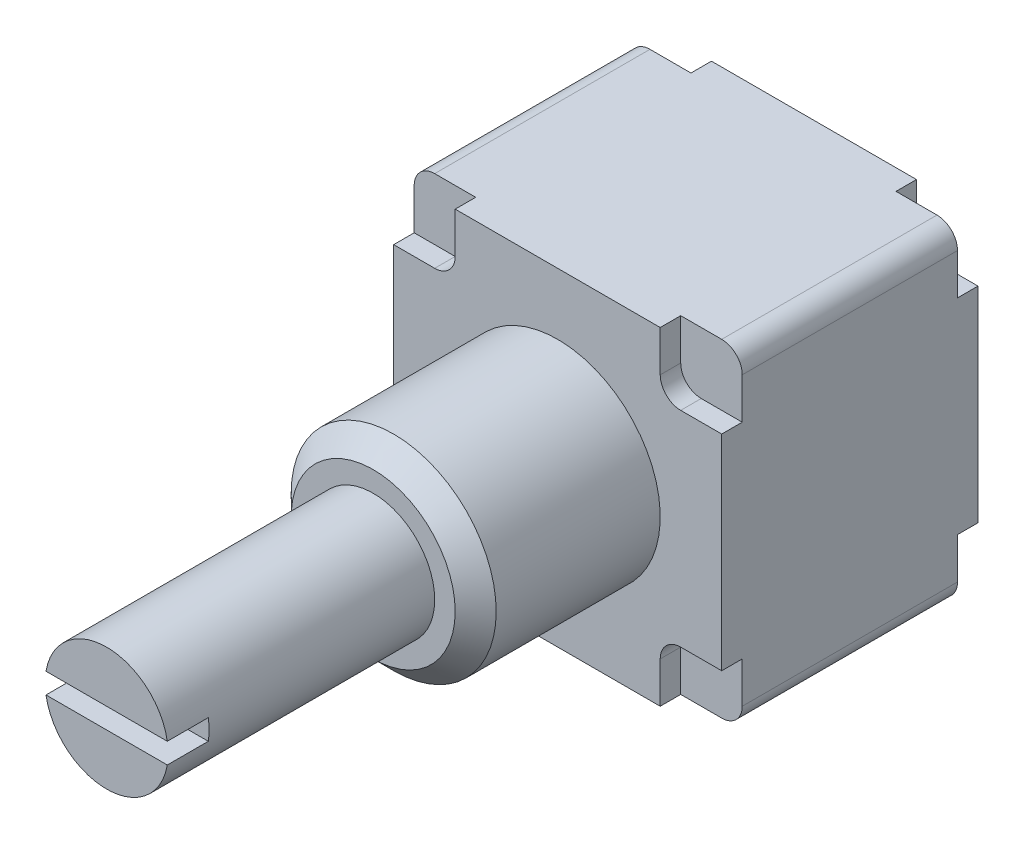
SolidWorks part; units mm, degrees
ref_plane "Plan de face" through (0, 0, 0) normal (0, 0, 1) x (1, 0, 0)
ref_plane "Plan de dessus" through (0, 0, 0) normal (0, 1, 0) x (1, 0, 0)
ref_plane "Plan de droite" through (0, 0, 0) normal (1, 0, 0) x (0, 0, -1)
sketch "Esquisse1" plane through (0, 0, 0) normal (0, 0, 1) x (1, 0, 0)
  line L1 (0, 0) -> (16, 0)
  line L2 (0, 0) -> (0, 16)
  line L3 (0, 16) -> (16, 16)
  line L4 (16, 0) -> (16, 16)
  dimension "D1" = 16
  dimension "D2" = 16
extrude "Extrusion1" add sketch "Esquisse1" along normal blind 12.5
fillet "Congé1" radius 1 4 edges at (16, 0, 6.25) (0, 0, 6.25) (16, 16, 6.25) (0, 16, 6.25)
sketch "Esquisse2" plane through (0, 0, 12.5) normal (0, 0, 1) x (1, 0, 0)
  line L0 (0, 8) -> (16, 8) construction
  line L1 (0, 15) -> (0, 1) construction
  line L2 (16, 1) -> (16, 15) construction
  circle A0 centre (8, 8) radius 5
  dimension "D1" = 10
extrude "Extrusion2" add sketch "Esquisse2" along normal blind 9
chamfer "Chanfrein1" distance 1 angle 45 1 edges at (13, 8, 21.5)
sketch "Esquisse3" plane through (0, 0, 21.5) normal (0, 0, 1) x (1, 0, 0)
  circle A0 centre (8, 8) radius 3
  dimension "D1" = 6
extrude "Extrusion3" add sketch "Esquisse3" along normal blind 13
sketch "Esquisse4" plane through (0, 0, 34.5) normal (0, 0, 1) x (1, 0, 0)
  line L0 (8, 8) -> (14.8398, 8) construction
  line L1 (4.6023, 8.5) -> (11.5975, 8.5)
  line L2 (4.6023, 8.5) -> (4.6023, 7.5)
  line L3 (4.6023, 7.5) -> (11.5975, 7.5)
  line L4 (11.5975, 8.5) -> (11.5975, 7.5)
  dimension "D1" = 1
extrude "Enlèv. mat.-Extru.1" cut sketch "Esquisse4" against normal blind 2
sketch "Esquisse5" plane through (0, 0, 12.5) normal (0, 0, 1) x (1, 0, 0)
  line L0 (8, 16) -> (8, 0) construction
  line L1 (15, 16) -> (1, 16) construction
  line L2 (1, 0) -> (15, 0) construction
  line L3 (16, 8) -> (0, 8) construction
  line L4 (16, 1) -> (16, 15) construction
  line L5 (0, 15) -> (0, 1) construction
  line L6 (13, 17.6785) -> (13, 14)
  line L7 (-0.8069, 17.6785) -> (3, 17.6785)
  line L8 (-0.8069, 17.6785) -> (-0.8069, 13)
  line L9 (-0.8069, 13) -> (2, 13)
  line L10 (3, 17.6785) -> (3, 14)
  line L11 (16.8069, 13) -> (14, 13)
  line L12 (16.8069, 17.6785) -> (16.8069, 13)
  line L13 (16.8069, 17.6785) -> (13, 17.6785)
  line L14 (16.8069, -1.6785) -> (13, -1.6785)
  line L15 (16.8069, -1.6785) -> (16.8069, 3)
  line L16 (16.8069, 3) -> (14, 3)
  line L17 (3, -1.6785) -> (3, 2)
  line L18 (-0.8069, 3) -> (2, 3)
  line L19 (-0.8069, -1.6785) -> (-0.8069, 3)
  line L20 (-0.8069, -1.6785) -> (3, -1.6785)
  line L21 (13, -1.6785) -> (13, 2)
  arc A0 (2, 13) -> (3, 14) centre (2, 14) ccw
  arc A1 (14, 13) -> (13, 14) centre (14, 14) cw
  arc A2 (14, 3) -> (13, 2) centre (14, 2) ccw
  arc A3 (2, 3) -> (3, 2) centre (2, 2) cw
  dimension "D3" = 1
  dimension "D1" = 3
  dimension "D2" = 3
extrude "Enlèv. mat.-Extru.2" cut sketch "Esquisse5" against normal blind 1
sketch "Esquisse6" plane through (0, 0, 0) normal (0, 0, -1) x (-1, 0, 0)
  line L4 (0, 13) -> (0, 15)
  line L5 (-2, 13) -> (0, 13)
  line L6 (-3, 16) -> (-3, 14)
  line L7 (-1, 16) -> (-3, 16)
  line L8 (0, 13) -> (0, 15)
  line L9 (-2, 13) -> (0, 13)
  line L10 (-3, 16) -> (-3, 14)
  line L11 (-1, 16) -> (-3, 16)
  line L12 (-13, 16) -> (-15, 16)
  line L13 (-13, 14) -> (-13, 16)
  line L14 (-16, 13) -> (-14, 13)
  line L15 (-16, 15) -> (-16, 13)
  line L16 (-13, 16) -> (-15, 16)
  line L17 (-13, 14) -> (-13, 16)
  line L18 (-16, 13) -> (-14, 13)
  line L19 (-16, 15) -> (-16, 13)
  line L20 (-3, 0) -> (-1, 0)
  line L21 (-3, 2) -> (-3, 0)
  line L22 (0, 3) -> (-2, 3)
  line L23 (0, 1) -> (0, 3)
  line L24 (-3, 0) -> (-1, 0)
  line L25 (-3, 2) -> (-3, 0)
  line L26 (0, 3) -> (-2, 3)
  line L27 (0, 1) -> (0, 3)
  line L28 (-15, 0) -> (-13, 0)
  line L29 (-16, 3) -> (-16, 1)
  line L30 (-14, 3) -> (-16, 3)
  line L31 (-13, 0) -> (-13, 2)
  line L32 (-15, 0) -> (-13, 0)
  line L33 (-16, 3) -> (-16, 1)
  line L34 (-14, 3) -> (-16, 3)
  line L35 (-13, 0) -> (-13, 2)
  arc A2 (-3, 14) -> (-2, 13) centre (-2, 14) ccw
  arc A3 (0, 15) -> (-1, 16) centre (-1, 15) ccw
  arc A4 (-3, 14) -> (-2, 13) centre (-2, 14) ccw
  arc A5 (0, 15) -> (-1, 16) centre (-1, 15) ccw
  arc A6 (-15, 16) -> (-16, 15) centre (-15, 15) ccw
  arc A7 (-14, 13) -> (-13, 14) centre (-14, 14) ccw
  arc A8 (-15, 16) -> (-16, 15) centre (-15, 15) ccw
  arc A9 (-14, 13) -> (-13, 14) centre (-14, 14) ccw
  arc A10 (-1, 0) -> (0, 1) centre (-1, 1) ccw
  arc A11 (-2, 3) -> (-3, 2) centre (-2, 2) ccw
  arc A12 (-1, 0) -> (0, 1) centre (-1, 1) ccw
  arc A13 (-2, 3) -> (-3, 2) centre (-2, 2) ccw
  arc A14 (-16, 1) -> (-15, 0) centre (-15, 1) ccw
  arc A15 (-13, 2) -> (-14, 3) centre (-14, 2) ccw
  arc A16 (-16, 1) -> (-15, 0) centre (-15, 1) ccw
  arc A17 (-13, 2) -> (-14, 3) centre (-14, 2) ccw
  dimension "D1" = 0
  dimension "D2" = 0
  dimension "D3" = 0
  dimension "D4" = 0
extrude "Enlèv. mat.-Extru.3" cut sketch "Esquisse6" against normal blind 1
